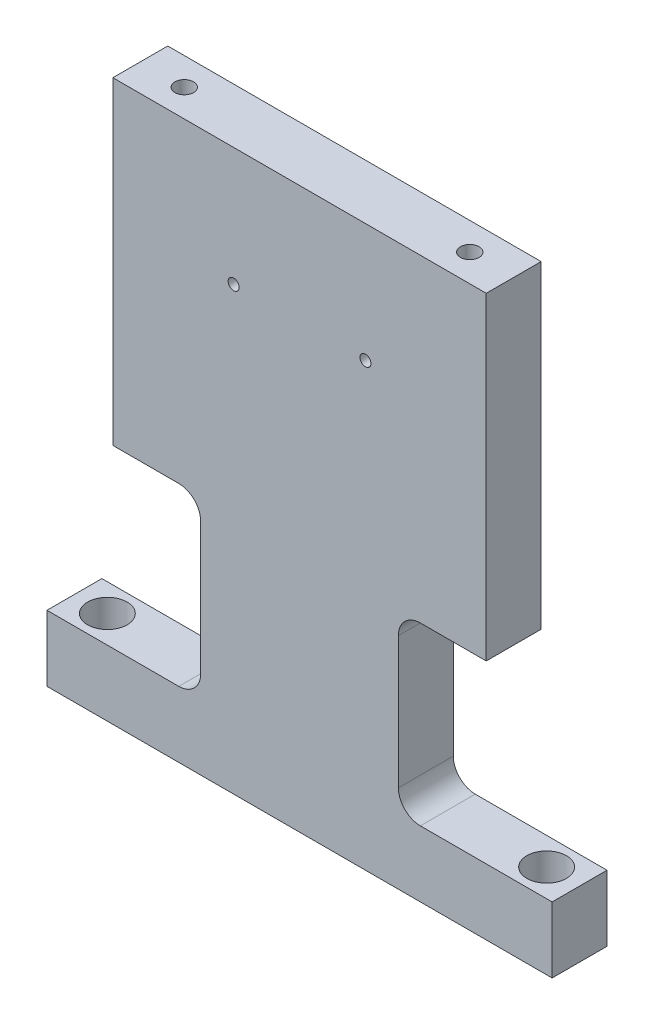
SolidWorks part; units mm, degrees
ref_plane "Frontal" through (0, 0, 0) normal (0, 0, 1) x (1, 0, 0)
ref_plane "Horizontal" through (0, 0, 0) normal (0, 1, 0) x (1, 0, 0)
ref_plane "Vertical" through (0, 0, 0) normal (1, 0, 0) x (0, 0, -1)
imported_body "Importée1"
other "SupprimerFace5"
other "SupprimerFace6"
sketch "Esquisse7" plane through (0, 0, 25) normal (0, 0, 1) x (1, 0, 0)
  line L0 (85, 0) -> (85, 48.2824) construction
  line L1 (0, 0) -> (170, 0) construction
  line L2 (170, 30) -> (140, 30) construction
  line L3 (-30, 30) -> (200, 30)
  line L4 (-30, 30) -> (-30, 0)
  line L5 (-30, 0) -> (200, 0)
  line L6 (200, 30) -> (200, 0)
  line L7 (-30, 30) -> (200, 0) construction
  line L8 (-30, 0) -> (200, 30) construction
  point P5 (85, 15)
  dimension "D1" = 230
extrude "Extrusion1" add sketch "Esquisse7" against normal through all
hole_wizard "Chambrage pour vis à tête hexagonale M101" positions "Esquisse2" profile "Esquisse1" counterbore size "M10" standard "ISO"
sketch "Esquisse2" plane through (0, 30, 0) normal (0, 1, 0) x (-1, 0, 0)
  line L0 (-85, 25) -> (-85, 0) construction
  line L1 (-170, 25) -> (0, 25) construction
  line L2 (-170, 0) -> (0, 0) construction
  point P1 (15, 12.5)
  point P6 (-185, 12.5)
  dimension "D1" = 200
sketch "Esquisse1" plane through (-15, 30, 12.5) normal (1, 0, 0) x (0, 0, 1)
  line L0 (0, 0) -> (0, 30)
  line L1 (0, 30) -> (5.25, 30)
  line L3 (5.25, 30) -> (5.25, 13)
  line L4 (5.25, 13) -> (9, 13)
  line L5 (9, 13) -> (9, 0)
  line L7 (9, 0) -> (0, 0)
  line L11 (0, -6.35) -> (0, 107.95) construction
  dimension "Diamètre du perçage jusqu'au prochain" = 10.5
  dimension "Profondeur du perçage jusqu'au prochain" = 30
  dimension "Diamètre du chambrage" = 18
  dimension "Profondeur du chambrage" = 13
hole_wizard "Trou taraudé M101" positions "Esquisse5" profile "Esquisse4" tap size "M10" standard "ISO"
sketch "Esquisse5" plane through (0, 255, 0) normal (0, 1, 0) x (-1, 0, 0)
  line L0 (-170, 12.5) -> (0, 12.5) construction
  line L1 (-170, 25) -> (-170, 0) construction
  line L2 (0, 25) -> (0, 0) construction
  point P1 (-20, 12.5)
  point P4 (-150, 12.5)
  dimension "D1" = 20
  dimension "D2" = 130
sketch "Esquisse4" plane through (20, 255, 12.5) normal (1, 0, 0) x (0, 0, 1)
  line L0 (0, 0) -> (0, 32.5537)
  line L1 (0, 32.5537) -> (4.25, 30)
  line L2 (4.25, 30) -> (4.25, 0)
  line L5 (4.25, 0) -> (0, 0)
  line L10 (0, 32.5537) -> (-4.25, 30) construction
  line L11 (0, -6.35) -> (0, 107.95) construction
  dimension "Diamètre du trou pour taraudage" = 8.5
  dimension "Profondeur du trou pour taraudage" = 30
  dimension "Angle de pointe" = 118
